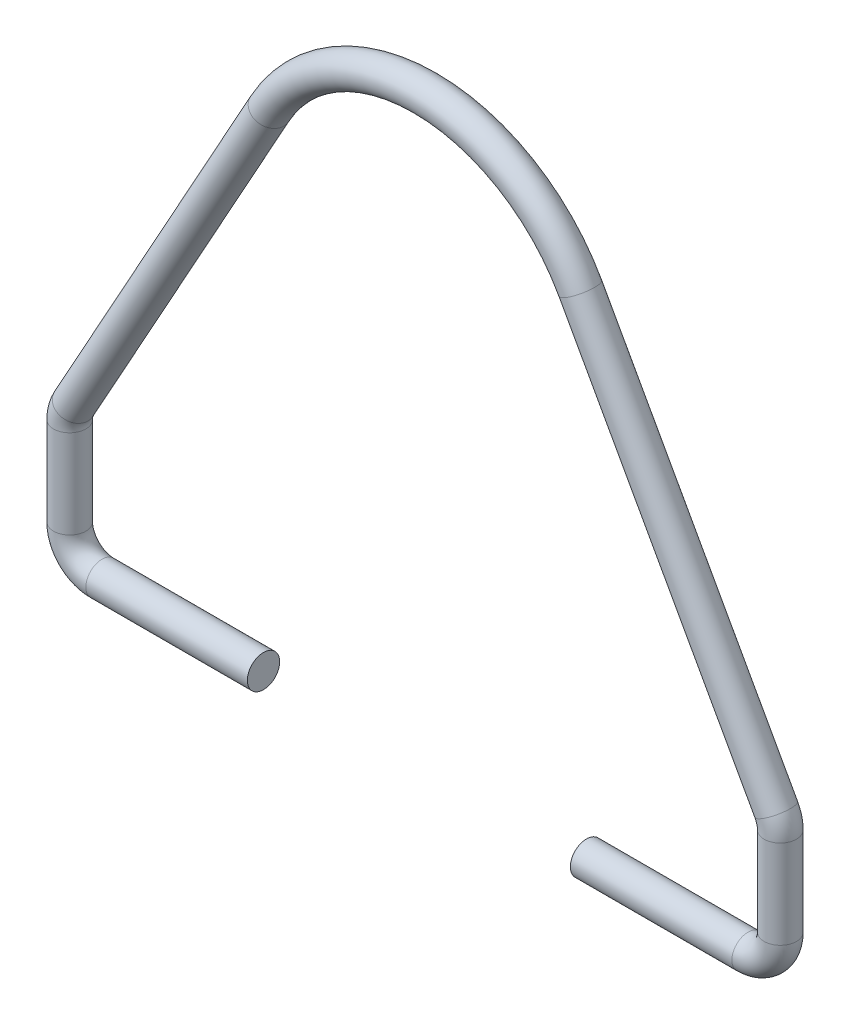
SolidWorks part; units mm, degrees
ref_plane "Спереди" through (0, 0, 0) normal (0, 0, 1) x (1, 0, 0)
ref_plane "Сверху" through (0, 0, 0) normal (0, 1, 0) x (1, 0, 0)
ref_plane "Справа" through (0, 0, 0) normal (1, 0, 0) x (0, 0, -1)
sketch "Эскиз1" plane through (0, 0, 0) normal (0, 0, 1) x (1, 0, 0)
  line L0 (-13.513, -12.5) -> (14.7979, -12.5) construction
  line L1 (0, 17.1218) -> (0, -20.1528) construction
  line L2 (-11, -0.7854) -> (-11, -20.1528) construction
  line L3 (-13.513, -8.5) -> (14.7979, -8.5) construction
  line L4 (-5, -12.5) -> (-10, -12.5)
  line L5 (-11, -11.5) -> (-11, -8.7586)
  line L6 (-10.8746, -8.2738) -> (-4.8104, 2.6664)
  line L7 (5, -12.5) -> (10, -12.5)
  line L8 (11, -11.5) -> (11, -8.7586)
  line L9 (10.8746, -8.2738) -> (4.8104, 2.6664)
  arc A0 (4.8104, 2.6664) -> (-4.8104, 2.6664) centre (0, 0) ccw
  arc A1 (-11, -8.7586) -> (-10.8746, -8.2738) centre (-10, -8.7586) cw
  arc A2 (-10, -12.5) -> (-11, -11.5) centre (-10, -11.5) cw
  arc A3 (10, -12.5) -> (11, -11.5) centre (10, -11.5) ccw
  arc A4 (11, -8.7586) -> (10.8746, -8.2738) centre (10, -8.7586) ccw
  point P17 (-11, -8.5)
  point P20 (-11, -12.5)
  dimension "D1" = 11
  dimension "D6" = 1
  dimension "D2" = 12.5
  dimension "D3" = 4
  dimension "D4" = 11
  dimension "D5" = 5
ref_plane "Плоскость1" through (-5, 0, 0) normal (1, 0, 0) x (0, 0, -1)
sketch "Эскиз2" plane through (-5, 0, 0) normal (1, 0, 0) x (0, 0, -1)
  circle A0 centre (0, -12.5) radius 0.5
  dimension "D1" = 1
sweep "По траектории1" add profiles "Эскиз2" path "Эскиз1"
